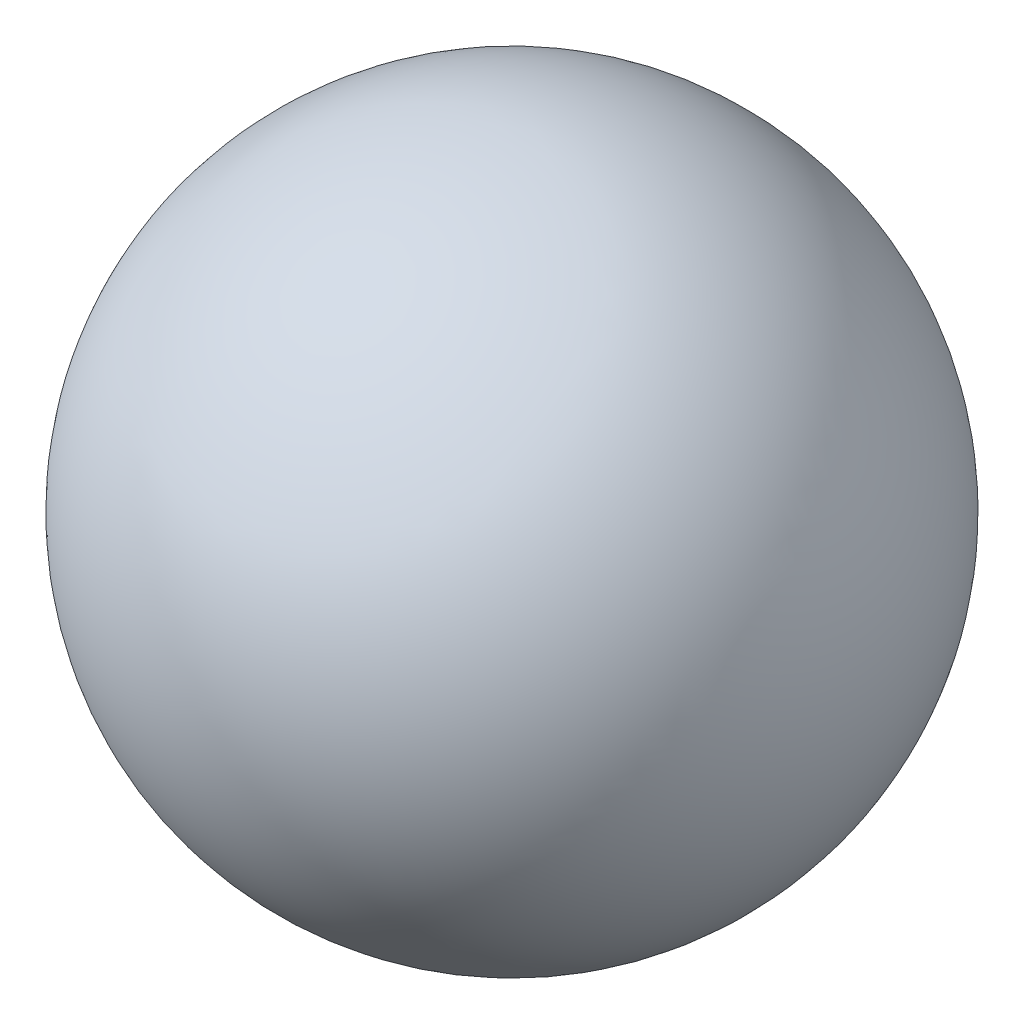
SolidWorks part; units mm, degrees
ref_plane "Face" through (0, 0, 0) normal (0, 0, 1) x (1, 0, 0)
ref_plane "Dessus" through (0, 0, 0) normal (0, 1, 0) x (1, 0, 0)
ref_plane "Droite" through (0, 0, 0) normal (1, 0, 0) x (0, 0, -1)
sketch "Esquisse2" plane through (0, 0, 0) normal (0, 0, 1) x (1, 0, 0)
  line L1 (-4.5, 0) -> (4.5, 0) construction
  line L4 (2, 0) -> (-2, 0)
  arc A2 (2, 0) -> (-2, 0) centre (0, 0) ccw
  dimension "D1" = 2
revolve "Révolution1" add sketch "Esquisse2" angle 360 about L1
